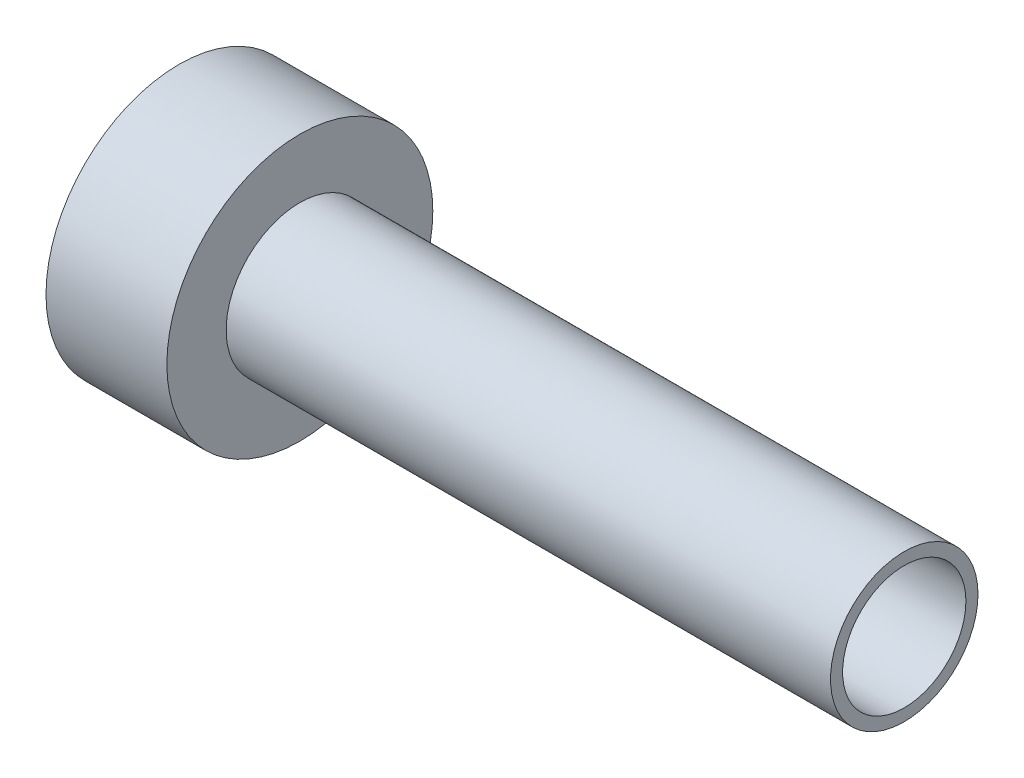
SolidWorks part; units mm, degrees
ref_plane "Alzado" through (0, 0, 0) normal (0, 0, 1) x (1, 0, 0)
ref_plane "Planta" through (0, 0, 0) normal (0, 1, 0) x (1, 0, 0)
ref_plane "Vista lateral" through (0, 0, 0) normal (1, 0, 0) x (0, 0, -1)
sketch "Croquis1" plane through (0, 0, 0) normal (1, 0, 0) x (0, 0, -1)
  circle A0 centre (0, 0) radius 55
  circle A1 centre (0, 0) radius 25.5
  dimension "D1" = 110
  dimension "D2" = 51
extrude "Saliente-Extruir1" add sketch "Croquis1" along normal blind 50
sketch "Croquis2" plane through (50, 0, 0) normal (1, 0, 0) x (0, 0, -1)
  circle A0 centre (0, 0) radius 25.5
  circle A1 centre (0, 0) radius 30.5
  circle A2 centre (0, 0) radius 25.5 construction
  dimension "D1" = 61
extrude "Saliente-Extruir2" add sketch "Croquis2" along normal blind 250
